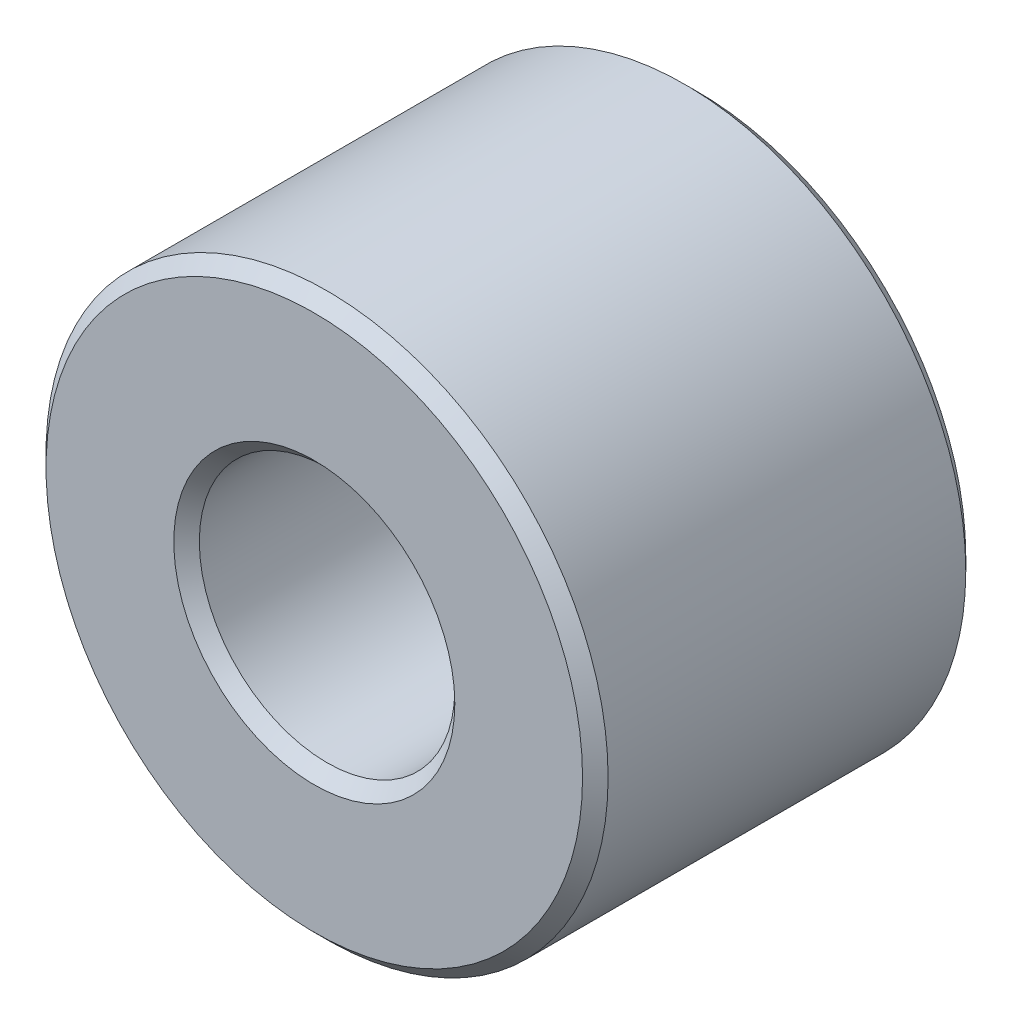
SolidWorks part; units mm, degrees
ref_plane "Front Plane" through (0, 0, 0) normal (0, 0, 1) x (1, 0, 0)
ref_plane "Top Plane" through (0, 0, 0) normal (0, 1, 0) x (1, 0, 0)
ref_plane "Right Plane" through (0, 0, 0) normal (1, 0, 0) x (0, 0, -1)
sketch "Sketch1" plane through (0, 0, 0) normal (0, 0, 1) x (1, 0, 0)
  circle A0 centre (0, 0) radius 5
  circle A1 centre (0, 0) radius 11
  dimension "D1" = 10
  dimension "D2" = 22
extrude "Boss-Extrude1" add sketch "Sketch1" along normal mid plane 15
chamfer "Chamfer1" distance 0.5 angle 45 4 edges at (5, 0, -7.5) (11, 0, -7.5) (5, 0, 7.5) (11, 0, 7.5)
